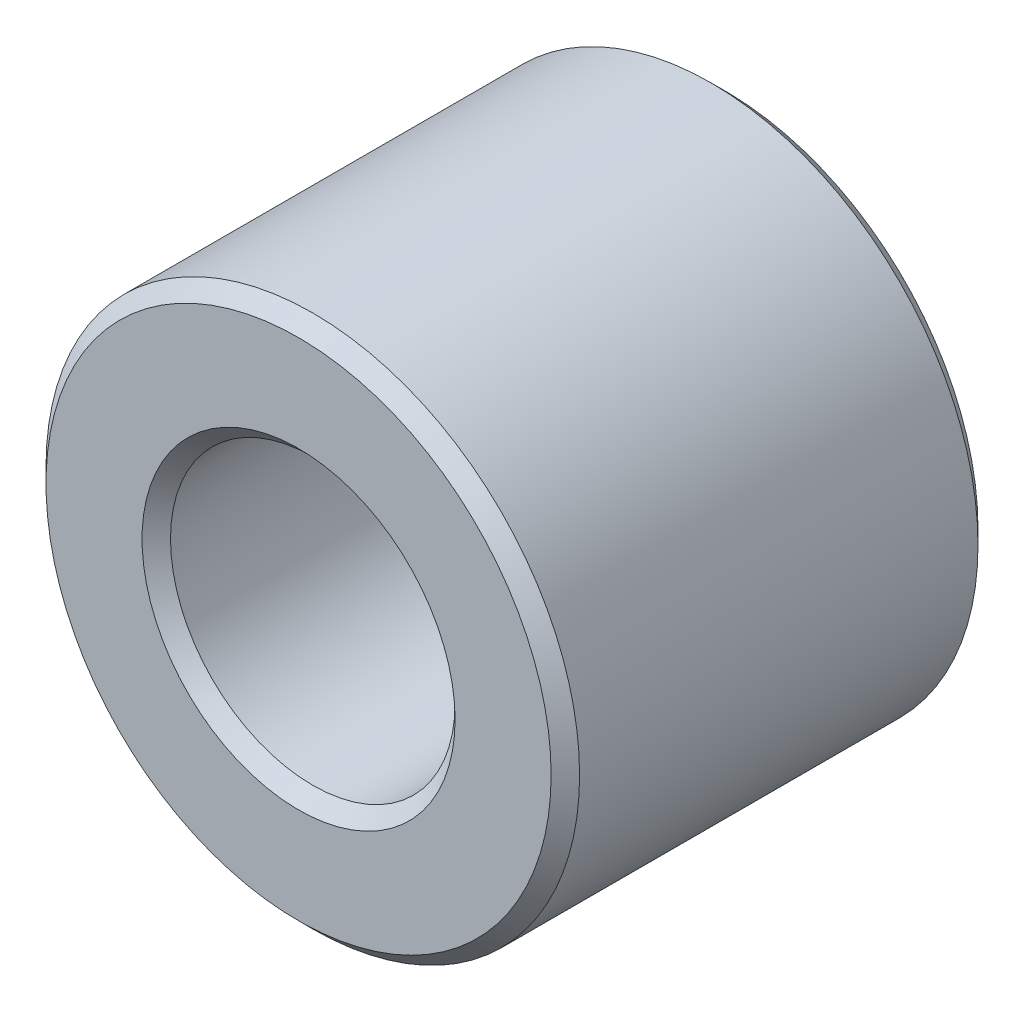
SolidWorks part; units mm, degrees
ref_plane "Front Plane" through (0, 0, 0) normal (0, 0, 1) x (1, 0, 0)
ref_plane "Top Plane" through (0, 0, 0) normal (0, 1, 0) x (1, 0, 0)
ref_plane "Right Plane" through (0, 0, 0) normal (1, 0, 0) x (0, 0, -1)
sketch "Sketch1" plane through (0, 0, 0) normal (0, 0, 1) x (1, 0, 0)
  circle A0 centre (0, 0) radius 16
  circle A1 centre (0, 0) radius 30
  dimension "D1" = 32
  dimension "D2" = 60
extrude "Boss-Extrude1" add sketch "Sketch1" along normal mid plane 48
chamfer "Chamfer1" distance 1.6 angle 45 4 edges at (16, 0, -24) (30, 0, -24) (16, 0, 24) (30, 0, 24)
